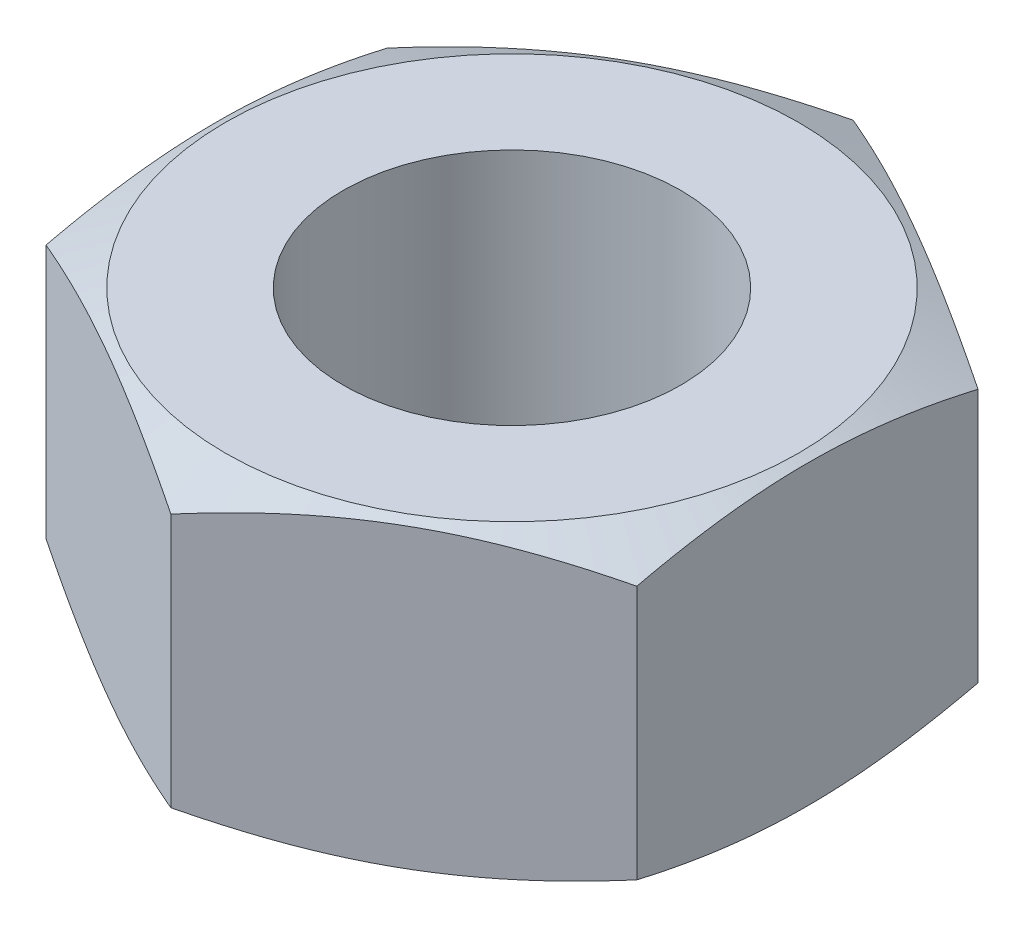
SolidWorks part; units mm, degrees
ref_plane "Front" through (0, 0, 0) normal (0, 0, 1) x (1, 0, 0)
ref_plane "Top" through (0, 0, 0) normal (0, 1, 0) x (1, 0, 0)
ref_plane "Right" through (0, 0, 0) normal (1, 0, 0) x (0, 0, -1)
sketch "Sketch1" plane through (0, 0, 0) normal (0, 0, 1) x (1, 0, 0)
  line L0 (0, -57.404) -> (0, 63.1444) construction
  line L1 (3.175, 0) -> (3.175, 5.7404)
  line L2 (3.175, 5.7404) -> (5.3893, 5.7404)
  line L3 (5.3893, 5.7404) -> (6.4158, 5.2617)
  line L4 (6.4158, 5.2617) -> (6.4158, 0.4787)
  line L5 (6.4158, 0.4787) -> (5.3893, 0)
  line L6 (5.3893, 0) -> (3.175, 0)
revolve "Base-Revolve" add sketch "Sketch1" angle 360 about L0
sketch "Sketch2" plane through (0, 0, 0) normal (0, 1, 0) x (1, 0, 0)
  line L0 (5.5562, 3.2079) -> (0, 6.4158)
  line L1 (0, 6.4158) -> (-5.5563, 3.2079)
  line L2 (-5.5563, 3.2079) -> (-5.5562, -3.2079)
  line L3 (-5.5562, -3.2079) -> (0, -6.4158)
  line L4 (0, -6.4158) -> (5.5563, -3.2079)
  line L5 (5.5563, -3.2079) -> (5.5562, 3.2079)
  line L6 (7.0574, 7.0574) -> (-7.0574, 7.0574)
  line L7 (-7.0574, 7.0574) -> (-7.0574, -7.0574)
  line L8 (-7.0574, -7.0574) -> (7.0574, -7.0574)
  line L9 (7.0574, -7.0574) -> (7.0574, 7.0574)
extrude "Cut-Extrude1" cut sketch "Sketch2" along normal blind 5.7404
